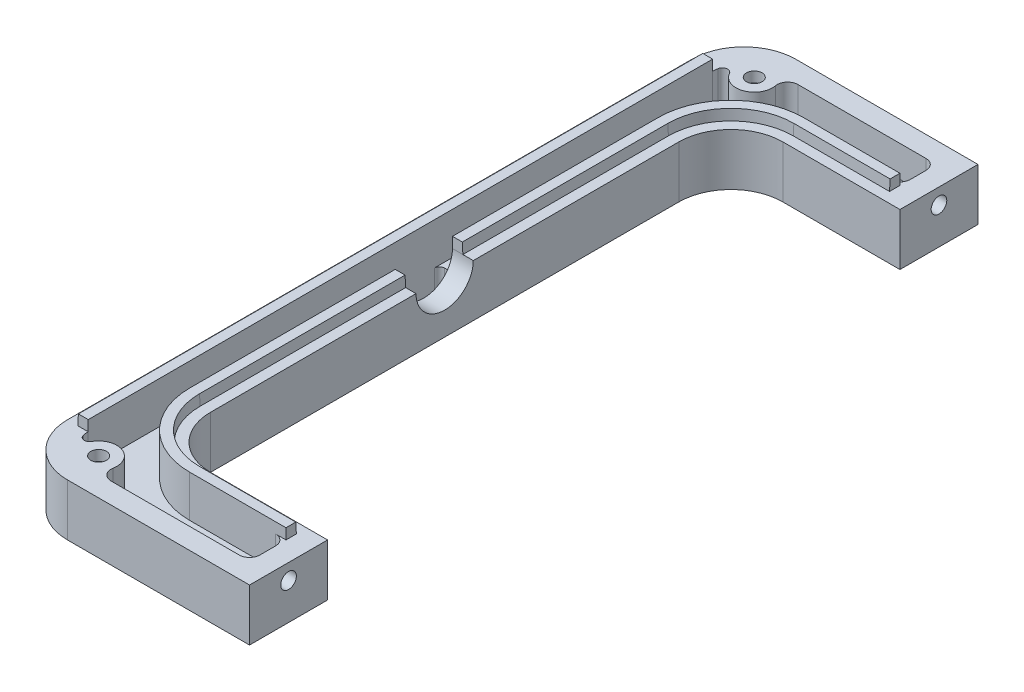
SolidWorks part; units mm, degrees
ref_plane "Front Plane" through (0, 0, 0) normal (0, 0, 1) x (1, 0, 0)
ref_plane "Top Plane" through (0, 0, 0) normal (0, 1, 0) x (1, 0, 0)
ref_plane "Right Plane" through (0, 0, 0) normal (1, 0, 0) x (0, 0, -1)
body saved out of another part "Stock-chassis7-1"
other "Lip&Groove3-Lip" parameters "LipHeight"=2.032, "LipWidth"=2, "LipDraftAngle"=3, "Clearance"=0, "Gap"=0, "upGap"=2.032, "D7"=2, "D8"=3, "D9"=0
fillet "Fillet1" radius 2 6 edges at (-91.6972, 4.1, 66) (-61.5, 4.1, -66) (-61.5, 4.1, -59) (-91.6972, 4.1, -66) (-61.5, 4.1, 66) (-61.5, 4.1, 59)
fillet "Fillet2" radius 1 14 edges at (-94, -0.9, 9.25) (-94, -0.9, 12.25) (-94, -0.9, 7.5) (-98.5, -0.9, 7.5) (-98.5, -0.9, -7.5) (-94, -0.9, -7.5) (-98.5, -0.9, -12.25) (-94, -0.9, -12.25) (-94, -0.9, -9.25) (-98.5, -0.9, -9.25) (-98.5, -0.9, 12.25) (-98.5, -0.9, 9.25) (-96.7896, 4.1, -64.1951) (-96.7896, 4.1, 64.1951)
